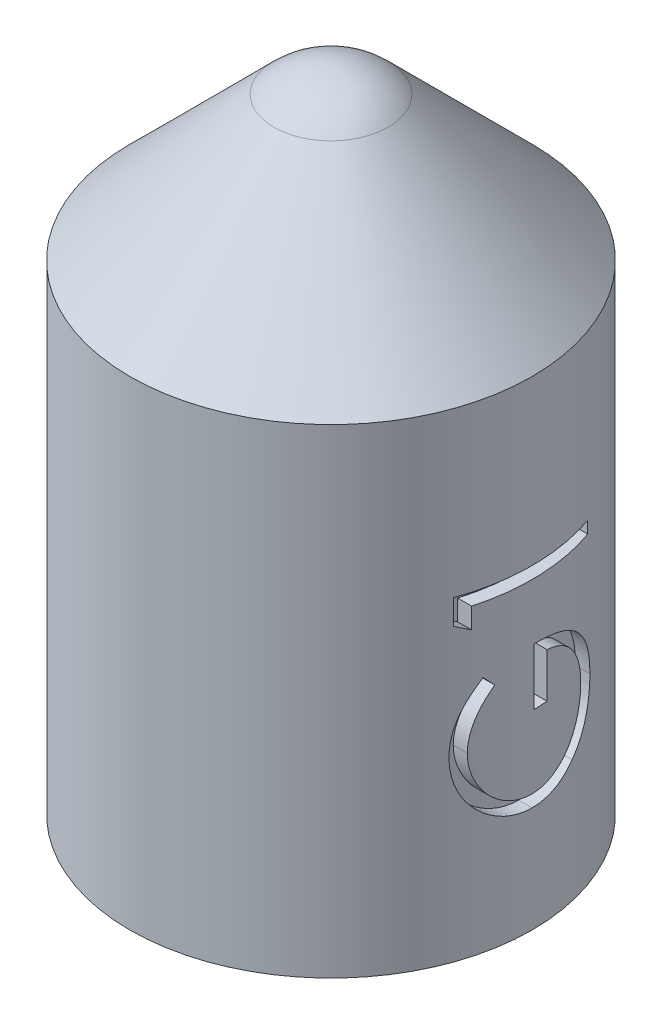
SolidWorks part; units mm, degrees
ref_plane "Plan de face" through (0, 0, 0) normal (0, 0, 1) x (1, 0, 0)
ref_plane "Plan de dessus" through (0, 0, 0) normal (0, 1, 0) x (1, 0, 0)
ref_plane "Plan de droite" through (0, 0, 0) normal (1, 0, 0) x (0, 0, -1)
sketch "Esquisse1" plane through (0, 0, 0) normal (0, 0, 1) x (1, 0, 0)
  line L0 (0, 0) -> (0, 61.7034) construction
  line L1 (-1.5, 3.75) -> (-1.5, 0.1754)
  line L2 (-1.5, 3.75) -> (0, 5.25) construction
  line L3 (-1, 4.25) -> (0, 4.25) construction
  line L4 (0, 0) -> (0, 5)
  line L5 (-1.5, 3.75) -> (-0.4268, 4.8232)
  arc A0 (-1.5, 0.1754) -> (0, 0) centre (0, 6.5) ccw
  arc A1 (0, 5) -> (-0.4268, 4.8232) centre (0, 4.3964) ccw
  dimension "D2" = 13
  dimension "D1" = 3
  dimension "D3" = 45
  dimension "D4" = 2
  dimension "D5" = 2.25
  dimension "D6" = 0.25
revolve "Révolution1" add sketch "Esquisse1" angle 360 about L0
ref_plane "Plan1" through (1.5, 0, 0) normal (1, 0, 0) x (0, 0, -1)
sketch "Esquisse2" plane through (1.5, 0, 0) normal (1, 0, 0) x (0, 0, -1)
  line L0 (0.5, 0) -> (0.5, 3.75) construction
  line L1 (1.5, 3.75) -> (-1.5, 3.75) construction
  text T0 "G1" font "Century Gothic" height 1
  dimension "D1" = 0.5
extrude "Enlèv. mat.-Extru.1" cut sketch "Esquisse2" against normal offset from surface (0.1 mm away) 0.1
ref_plane "Plan2" through (-1.5, 0, 0) normal (-1, 0, 0) x (0, 0, 1)
sketch "Esquisse3" plane through (-1.5, 0, 0) normal (-1, 0, 0) x (0, 0, 1)
  line L0 (0.5, 3.75) -> (0.5, 0) construction
  line L1 (-1.5, 3.75) -> (1.5, 3.75) construction
  text T0 "G1" font "Century Gothic" height 1
  dimension "D1" = 0.5
extrude "Enlèv. mat.-Extru.2" cut sketch "Esquisse3" against normal offset from surface (0.1576 mm away) 0.1
